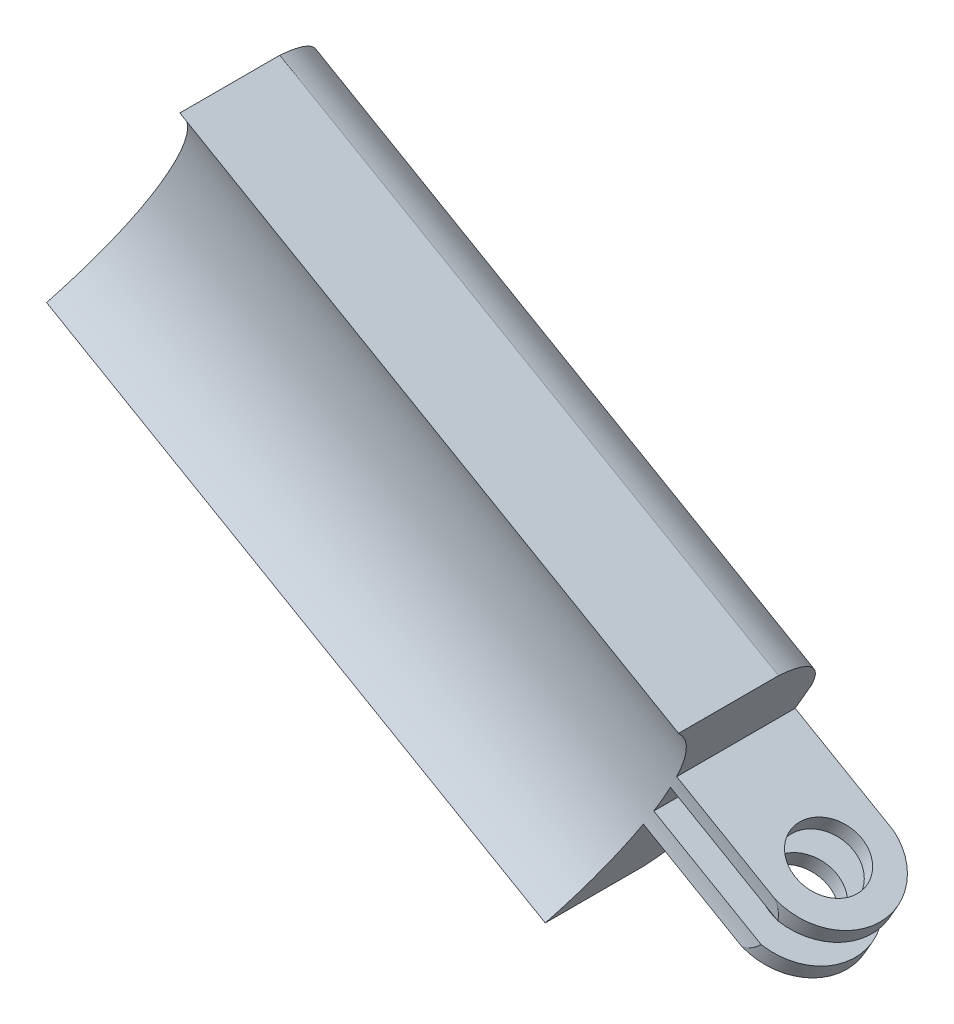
SolidWorks part; units mm, degrees
ref_plane "Front Plane" through (0, 0, 0) normal (0, 0, 1) x (1, 0, 0)
ref_plane "Top Plane" through (0, 0, 0) normal (0, 1, 0) x (1, 0, 0)
ref_plane "Right Plane" through (0, 0, 0) normal (1, 0, 0) x (0, 0, -1)
sketch "草图1" plane through (0, 0, 0) normal (0, 0, 1) x (1, 0, 0)
  line L0 (-43.0406, 51.4615) -> (-13.105, 34.1782)
  line L1 (-43.0406, 51.4615) -> (-51.0406, 37.6051)
  line L2 (-51.0406, 37.6051) -> (-21.105, 20.3218)
  line L3 (-21.105, 20.3218) -> (-13.105, 34.1782)
  dimension "D1" = 16
extrude "凸台-拉伸1" add sketch "草图1" along normal blind 10
sketch "草图2" plane through (-54.5639, 31.5025, 0) normal (-0.866, 0.5, 0) x (0, 0, 1)
  line L0 (10, 23.0467) -> (0, 23.0467) construction
  line L1 (0, 23.0467) -> (0, 7.0467) construction
  line L2 (10, 7.0467) -> (0, 7.0467) construction
  line L3 (0, 19.0467) -> (0, 11.0467)
  line L4 (4, 23.0467) -> (4, 32.1682)
  line L5 (4, 32.1682) -> (-13.6027, 32.1682)
  line L6 (-13.6027, 32.1682) -> (-13.6027, 1.3234)
  line L7 (-13.6027, 1.3234) -> (4, 1.3234)
  line L8 (4, 1.3234) -> (4, 7.0467)
  arc A0 (4, 23.0467) -> (0, 19.0467) centre (4.9155, 18.1312) ccw
  arc A1 (4, 7.0467) -> (0, 11.0467) centre (4.9155, 11.9622) cw
  dimension "D3" = 4
  dimension "D1" = 4
  dimension "D2" = 4
  dimension "D4" = 4
extrude "切除-拉伸1" cut sketch "草图2" against normal blind 40
sketch "草图3" plane through (-54.5639, 31.5025, 0) normal (-0.866, 0.5, 0) x (0, 0, 1)
  arc A0 (10, 23.0467) -> (10, 7.0467) centre (18.9443, 15.0467) ccw
extrude "切除-拉伸2" cut sketch "草图3" against normal blind 40 and the other way through all
sketch "草图4" plane through (-24.6284, 14.2192, 0) normal (0.866, -0.5, 0) x (0, 0, -1)
  line L0 (-7.1121, 17.0467) -> (0, 17.0467)
  line L1 (0, 11.0467) -> (0, 19.0467) construction
  line L2 (0, 17.0467) -> (0, 16.0467)
  line L3 (0, 16.0467) -> (-6.986, 16.0467)
  line L4 (-10, 23.0467) -> (-4, 23.0467) construction
  line L6 (-7.1121, 13.0467) -> (0, 13.0467)
  line L7 (0, 13.0467) -> (0, 14.0467)
  line L8 (0, 14.0467) -> (-6.986, 14.0467)
  line L9 (-10, 7.0467) -> (-4, 7.0467) construction
  arc A0 (-10, 7.0467) -> (-10, 23.0467) centre (-18.9443, 15.0467) ccw construction
  arc A1 (-7.1121, 17.0467) -> (-6.986, 16.0467) centre (-18.9443, 15.0467) cw
  arc A2 (-6.986, 14.0467) -> (-7.1121, 13.0467) centre (-18.9443, 15.0467) cw
  dimension "D1" = 6
  dimension "D2" = 1
  dimension "D3" = 6
  dimension "D4" = 1
extrude "凸台-拉伸2" add sketch "草图4" along normal blind 10
sketch "草图5" plane through (6.5233, 11.2988, 0) normal (-0.5, -0.866, 0) x (0.866, -0.5, 0)
  line L5 (-18.4384, 7.1121) -> (-28.4384, 7.1121) construction
  line L6 (-18.4384, 0) -> (-28.4384, 0) construction
  line L7 (-21.6147, 7.1121) -> (-18.4384, 7.1121)
  line L8 (-18.4384, 7.1121) -> (-16.5581, 7.1121)
  line L9 (-16.5581, 7.1121) -> (-16.5581, 0)
  line L10 (-16.5581, 0) -> (-21.6147, 0)
  arc A0 (-21.6147, 7.1121) -> (-21.6147, 0) centre (-22.0171, 3.5561) cw
extrude "切除-拉伸3" cut sketch "草图5" against normal blind 10
sketch "草图6" plane through (6.5233, 11.2988, 0) normal (-0.5, -0.866, 0) x (0.866, -0.5, 0)
  circle A0 centre (-22.0171, 3.5561) radius 2
  arc A1 (-21.6147, 0) -> (-21.6147, 7.1121) centre (-22.0171, 3.5561) ccw construction
  dimension "D1" = 0
extrude "切除-拉伸4" cut sketch "草图6" against normal blind 10
